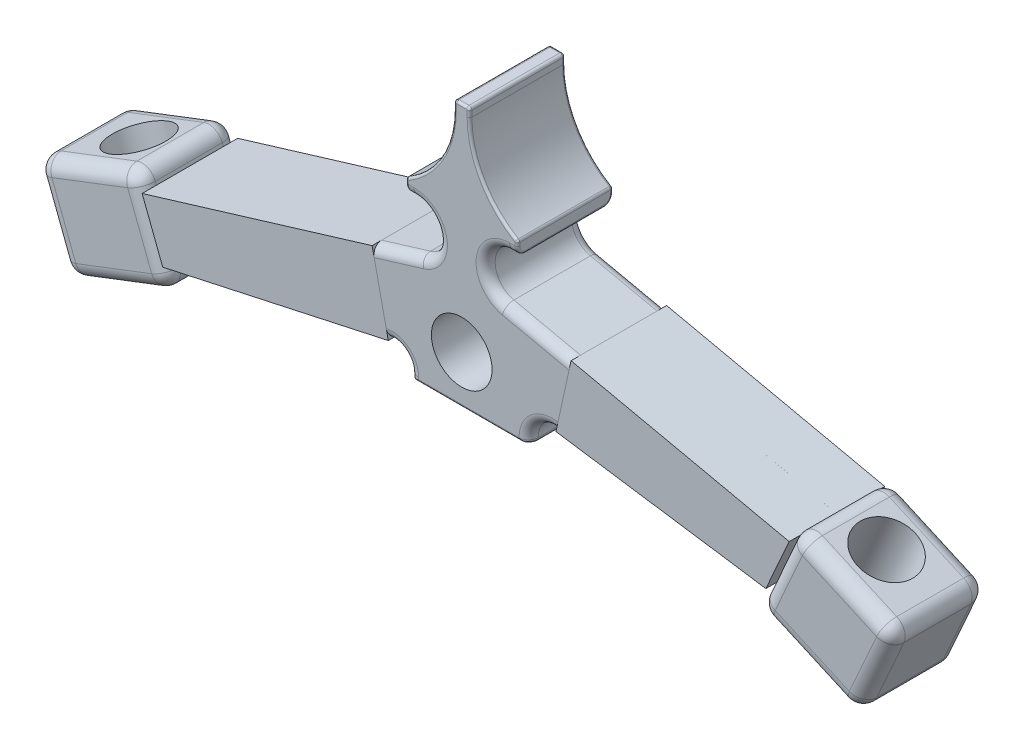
SolidWorks part; units mm, degrees
ref_plane "Спереди" through (0, 0, 0) normal (0, 0, 1) x (1, 0, 0)
ref_plane "Сверху" through (0, 0, 0) normal (0, 1, 0) x (1, 0, 0)
ref_plane "Справа" through (0, 0, 0) normal (1, 0, 0) x (0, 0, -1)
sketch "Эскиз1" plane through (0, 0, 0) normal (0, 0, 1) x (1, 0, 0)
  line L0 (0, 22.5) -> (0, -27.6904) construction
  line L1 (-5.38, -5) -> (6.88, -5)
  line L2 (7, -4.7455) -> (7, -4.88)
  line L3 (9.8652, -2.2723) -> (31.8283, -5.5155)
  line L4 (43.3051, 7.9688) -> (27.2773, -28.0304) construction
  line L5 (38.534, 4.6285) -> (24.6481, -26.5599) construction
  line L6 (31.8283, -5.5155) -> (34.2688, -0.0343)
  line L7 (34.2688, -0.0343) -> (4.4674, 6.4635)
  line L8 (9.8652, -2.2723) -> (11.4385, 4.9435) construction
  line L9 (-24.3174, 11.4061) -> (21.101, 11.4061) construction
  line L10 (2.5, 30.6701) -> (2.5, 16.1136) construction
  line L11 (-2.5, 30.6701) -> (-2.5, 16.1136) construction
  line L12 (-7.6835, -2.7953) -> (-31.292, -7.9428)
  line L13 (-39.703, 0.0166) -> (-27.7319, -31.1692) construction
  line L14 (-36.8657, 0.9965) -> (-28.1169, -21.7949) construction
  line L15 (-33.4422, -2.3413) -> (-31.292, -7.9428)
  line L16 (-33.4422, -2.3413) -> (-4.2738, 6.5139)
  line L17 (-5.5, -4.5539) -> (-5.5, -4.88)
  line L18 (-24.3174, 12.9061) -> (21.101, 12.9061) construction
  line L19 (-5.825, 12.7343) -> (-5.825, 11.7061)
  line L20 (-5.525, 11.4061) -> (-5, 11.4061)
  line L21 (5.825, 12.7343) -> (5.825, 11.7061)
  line L22 (5.525, 11.4061) -> (5, 11.4061)
  line L23 (-0.5141, 22.5) -> (0.5141, 22.5)
  line L24 (0.8141, 24.3476) -> (0.8141, 15.7225) construction
  line L25 (0.8141, 22.2) -> (0.8141, 21.5726)
  line L26 (-0.8141, 22.2) -> (-0.8141, 21.5726)
  line L27 (-42.4905, -14.5787) -> (-25.0412, -7.8805) construction
  line L28 (27.9625, -6.5003) -> (41.2129, -12.3997) construction
  line L29 (-7.6835, -2.7953) -> (0, -1.12) construction
  line L30 (-7.6835, -2.7953) -> (-9.3755, 4.9651) construction
  line L31 (10.6519, 1.3356) -> (33.0485, -2.7749) construction
  line L32 (-8.5295, 1.0849) -> (-32.3671, -5.142) construction
  circle A0 centre (0, 0) radius 3.175
  arc A1 (7, -4.7455) -> (9.8652, -2.2723) centre (9.5, -4.7455) cw
  arc A2 (5, 11.4061) -> (4.4674, 6.4635) centre (5, 8.9061) ccw
  arc A3 (-4.2738, 6.5139) -> (-5, 11.4061) centre (-5, 8.9061) ccw
  arc A4 (-7.6835, -2.7953) -> (-5.5, -4.5539) centre (-7.3, -4.5539) cw
  arc A5 (0.8141, 21.5726) -> (5.6791, 12.9918) centre (10.8141, 21.5726) ccw
  arc A6 (-0.8141, 21.5726) -> (-5.6791, 12.9918) centre (-10.8141, 21.5726) cw
  arc A7 (-0.5141, 22.5) -> (-0.8141, 22.2) centre (-0.5141, 22.2) ccw
  arc A8 (0.5141, 22.5) -> (0.8141, 22.2) centre (0.5141, 22.2) cw
  arc A9 (5.825, 11.7061) -> (5.525, 11.4061) centre (5.525, 11.7061) cw
  arc A10 (5.825, 12.7343) -> (5.6791, 12.9918) centre (5.525, 12.7343) ccw
  arc A11 (-5.825, 12.7343) -> (-5.6791, 12.9918) centre (-5.525, 12.7343) cw
  arc A12 (-5.525, 11.4061) -> (-5.825, 11.7061) centre (-5.525, 11.7061) cw
  arc A13 (7, -4.88) -> (6.88, -5) centre (6.88, -4.88) cw
  arc A14 (-5.38, -5) -> (-5.5, -4.88) centre (-5.38, -4.88) cw
  point P11 (7, -1.8492)
  point P38 (-5.5, -2.3192)
  point P56 (-0.8141, 22.5)
  point P59 (0.8141, 22.5)
  point P62 (5.825, 11.4061)
  point P65 (5.825, 12.9061)
  point P68 (-5.825, 12.9061)
  point P71 (-5.825, 11.4061)
  dimension "D1" = 6.35
  dimension "D7" = 2.5
  dimension "D14" = 5
  dimension "D24" = 1.8
  dimension "D27" = 20
  dimension "D28" = 0.3
  dimension "D29" = 0.12
  dimension "D2" = 5
  dimension "D3" = 7
  dimension "D4" = 8.4
  dimension "D5" = 4
  dimension "D6" = 24.8283
  dimension "D8" = 24
  dimension "D9" = 36.32
  dimension "D10" = 3
  dimension "D11" = 6
  dimension "D12" = 12.3
  dimension "D13" = 5
  dimension "D15" = 22.5
  dimension "D16" = 12.3
  dimension "D17" = 45
  dimension "D18" = 37.06
  dimension "D19" = 3
  dimension "D20" = 4
  dimension "D21" = 5.5
  dimension "D22" = 6
  dimension "D23" = 1.12
  dimension "D25" = 1.5
  dimension "D26" = 5.825
  dimension "D30" = 2.182
  dimension "D31" = 2.472
extrude "Бобышка-Вытянуть1" add sketch "Эскиз1" along normal blind 10
sketch "Эскиз2" plane through (1.5481, 7.1, 0) normal (0.213, 0.977, 0) x (0.977, -0.213, 0)
  line L0 (10.1228, 0) -> (10.1228, -10)
  line L1 (33.4894, -10) -> (2.988, -10) construction
  line L2 (33.4894, -10) -> (33.4894, 0)
ref_plane "Плоскость1" through (9.8905, -2.1565, 0) normal (-0.977, 0.213, 0) x (0, 0, 1)
sketch "Эскиз3" plane through (-2.1713, 7.1522, 0) normal (-0.2905, 0.9569, 0) x (0.9569, 0.2905, 0)
  line L0 (-7.5288, 0) -> (-7.5288, -10)
  line L1 (-2.1972, -10) -> (-32.6802, -10) construction
  line L2 (-32.6802, 0) -> (-32.6802, -10)
ref_plane "Плоскость2" through (-7.9166, -1.7261, 0) normal (-0.977, -0.213, 0) x (0, 0, 1)
split "Разделить1" trim tools "Плоскость1" bodies to split 101 resulting bodies 102 103
split "Разделить3" trim tools "Плоскость2" bodies to split 102 resulting bodies 105 106
fillet "Скругление4" radius 1 4 edges at (7.953, 5.7035, 10) (2.5144, 9.1739, 10) (5.2625, 11.4061, 10) (5.7371, 11.494, 10)
fillet "Скругление5" radius 1 4 edges at (7.953, 5.7035, 0) (2.5144, 9.1739, 0) (5.2625, 11.4061, 0) (5.7371, 11.494, 0)
fillet "Скругление6" radius 1 3 edges at (6.9649, -4.9649, 10) (7, -4.8127, 10) (7.8664, -2.853, 10)
fillet "Скругление7" radius 1 3 edges at (6.9649, -4.9649, 0) (7, -4.8127, 0) (7.8664, -2.853, 0)
fillet "Скругление8" radius 1 4 edges at (-5.7371, 11.494, 10) (-5.2625, 11.4061, 10) (-2.5271, 9.2732, 10) (-6.8246, 5.7395, 10)
fillet "Скругление9" radius 1 4 edges at (-5.7371, 11.494, 0) (-5.2625, 11.4061, 0) (-2.5271, 9.2732, 0) (-6.8246, 5.7395, 0)
fillet "Скругление10" radius 1 3 edges at (-6.1709, -3.1521, 0) (-5.5, -4.717, 0) (-5.4649, -4.9649, 0)
fillet "Скругление11" radius 1 3 edges at (-6.1709, -3.1521, 10) (-5.5, -4.717, 10) (-5.4649, -4.9649, 10)
fillet "Скругление12" radius 0.25 32 edges at (5.7201, 11.4782, 0.6272) (5.797, 11.5796, 9.563) (5.825, 12.028, 9.9258) (5.825, 12.5702, 10) (5.786, 12.8823, 10) (2.115, 16.6406, 10) (0.8141, 21.8863, 10) (0.7263, 22.4121, 10) (0, 22.5, 10) (-0.7263, 22.4121, 10) (-0.8141, 21.8863, 10) (-5.797, 11.5796, 0.437) (-5.7201, 11.4782, 9.3728) (-5.825, 12.028, 9.9258) (-5.825, 12.5702, 10) (-5.786, 12.8823, 10) (5.825, 12.028, 0.0742) (5.825, 12.5702, 0) (5.786, 12.8823, 0) (2.115, 16.6406, 0) (0.8141, 21.8863, 0) (0.7263, 22.4121, 0) (0, 22.5, 0) (-0.7263, 22.4121, 0) (-0.8141, 21.8863, 0) (-5.825, 12.028, 0.0742) (-5.825, 12.5702, 0) (-5.786, 12.8823, 0) (0.75, -5, 0) (0.75, -5, 10) (-2.115, 16.6406, 10) (-2.115, 16.6406, 0)
sketch "Эскиз5" plane through (9.8905, -2.1565, 0) normal (-0.977, 0.213, 0) x (0, 0, 1)
  line L0 (0, 3.575) -> (10, 3.575) construction
  line L1 (5, 7.2668) -> (5, -0.1185) construction
  line L4 (1, -0.1185) -> (9, -0.1185)
  line L5 (0, 6.2668) -> (0, 0.8831)
  line L6 (9, 7.2668) -> (1, 7.2668)
  line L7 (10, 0.8831) -> (10, 6.2668)
  line L8 (1, -0.1185) -> (9, -0.1185)
  line L9 (0, 6.2668) -> (0, 0.8831)
  line L10 (9, 7.2668) -> (1, 7.2668)
  line L11 (10, 0.8831) -> (10, 6.2668)
  arc A2 (1, 7.2668) -> (0, 6.2668) centre (1, 6.2668) ccw
  arc A3 (10, 6.2668) -> (9, 7.2668) centre (9, 6.2668) ccw
  arc A4 (1, 7.2668) -> (0, 6.2668) centre (1, 6.2668) ccw
  arc A5 (10, 6.2668) -> (9, 7.2668) centre (9, 6.2668) ccw
  spline S2 degree 3 poles (1584.789, -2543.7862) (77.5069, 101.1342) (-6.0552, 6.5345) (0.3851, 0.0826) (0.496, 0.0081) (10.0275, -3.9515) (71.4137, 138.3627) (-2692.7779, 1311.8392) knots -16.714616 -16.714616 -16.714616 -16.714616 0.5 0.5 0.75 0.75 20.180106 20.180106 20.180106 20.180106 only from (0, 0.8831) to (1, -0.1185)
  spline S3 degree 3 poles (2541.7302, 1603.6618) (-91.1985, 76.9419) (3.3746, -6.178) (9.7997, 0.2679) (9.8739, 0.3789) (13.85, 9.9977) (-130.5199, 71.5734) (-1292.6871, -2697.1856) knots -16.683546 -16.683546 -16.683546 -16.683546 0.5 0.5 0.75 0.75 20.342713 20.342713 20.342713 20.342713 only from (9, -0.1185) to (10, 0.8831)
  spline S4 degree 3 poles (0, 0.8831) (0, 0.6188) (0.1085, 0.3596) (0.3851, 0.0826) (0.496, 0.0081) (0.7382, -0.0925) (0.8678, -0.1185) (1, -0.1185) knots 0 0 0 0 0.5 0.5 0.75 0.75 1 1 1 1
  spline S5 degree 3 poles (9, -0.1185) (9.2643, -0.1185) (9.5233, -0.0094) (9.7997, 0.2679) (9.8739, 0.3789) (9.974, 0.6213) (10, 0.751) (10, 0.8831) knots 0 0 0 0 0.5 0.5 0.75 0.75 1 1 1 1
  point P14 (5, 3.575)
  dimension "D1" = 0
ref_plane "Плоскость3" through (28.6122, -12.739, 0) normal (0.9135, -0.4067, 0) x (0, 0, -1)
sketch "Эскиз4" plane through (28.6122, -12.739, 0) normal (0.9135, -0.4067, 0) x (0, 0, -1)
  circle A0 centre (-5, 10.9071) radius 3
  dimension "D1" = 6
  dimension "D2" = 5
loft "По сечениям1" add profiles "Эскиз5", "Эскиз4"
sketch "Эскиз6" plane through (-7.9166, -1.7261, 0) normal (-0.977, -0.213, 0) x (0, 0, 1)
  line L0 (0, 2.877) -> (10, 2.8754) construction
  line L1 (5, 6.8484) -> (5, -1.0943) construction
  line L4 (1, -1.0943) -> (9, -1.0943)
  line L5 (10, -0.0943) -> (10, 5.8452)
  line L6 (9, 6.8484) -> (1, 6.8484)
  line L7 (0, 5.8452) -> (0, -0.0943)
  line L8 (1, -1.0943) -> (9, -1.0943)
  line L9 (10, -0.0943) -> (10, 5.8452)
  line L10 (9, 6.8484) -> (1, 6.8484)
  line L11 (0, 5.8452) -> (0, -0.0943)
  arc A2 (9, -1.0943) -> (10, -0.0943) centre (9, -0.0943) ccw
  arc A3 (0, -0.0943) -> (1, -1.0943) centre (1, -0.0943) ccw
  arc A4 (9, -1.0943) -> (10, -0.0943) centre (9, -0.0943) ccw
  arc A5 (0, -0.0943) -> (1, -1.0943) centre (1, -0.0943) ccw
  ellipse E2 centre (9, 5.8452) end of major axis (9, 6.8484) minor radius 1 (10, 5.8452) -> (9, 6.8484) ccw
  ellipse E3 centre (1, 5.8452) end of major axis (1, 6.8484) minor radius 1 (1, 6.8484) -> (0, 5.8452) ccw
  ellipse E4 centre (9, 5.8452) end of major axis (9, 6.8484) minor radius 1 (10, 5.8452) -> (9, 6.8484) ccw
  ellipse E5 centre (1, 5.8452) end of major axis (1, 6.8484) minor radius 1 (1, 6.8484) -> (0, 5.8452) ccw
  point P9 (5, 2.8762)
  dimension "D1" = 0
ref_plane "Плоскость4" through (-29.9306, -11.4893, 0) normal (0.9336, 0.3584, 0) x (0, 0, -1)
sketch "Эскиз7" plane through (-29.9306, -11.4893, 0) normal (0.9336, 0.3584, 0) x (0, 0, -1)
  circle A0 centre (-5, 6.7988) radius 3
  dimension "D1" = 6
  dimension "D2" = 5
loft "По сечениям2" add profiles "Эскиз6", "Эскиз7"
sketch "Эскиз8" plane through (28.6122, -12.739, 0) normal (0.9135, -0.4067, 0) x (0, 0, -1)
  line L0 (-5, 10.9071) -> (0, 10.9071) construction
  line L1 (-10, 15.4351) -> (0, 15.4351)
  line L2 (-10, 15.4351) -> (-10, 5.4351)
  line L3 (-10, 5.4351) -> (0, 5.4351)
  line L4 (0, 15.4351) -> (0, 5.4351)
  line L5 (-5, 10.9071) -> (-10, 10.9071) construction
  dimension "D1" = 10
extrude "Бобышка-Вытянуть2" add sketch "Эскиз8" along normal blind 11.5
sketch "Эскиз9" plane through (6.278, 14.1006, 0) normal (0.4067, 0.9135, 0) x (0.9135, -0.4067, 0)
  line L0 (42.82, 0) -> (31.32, 0) construction
  line L1 (31.32, 0) -> (31.32, -10) construction
  circle A0 centre (36.32, -5) radius 3
  dimension "D1" = 6
  dimension "D2" = 5
  dimension "D3" = 5
extrude "Вырез-Вытянуть1" cut sketch "Эскиз9" against normal blind 11.5
sketch "Эскиз10" plane through (-29.9306, -11.4893, 0) normal (0.9336, 0.3584, 0) x (0, 0, -1)
  line L1 (0, 11.6168) -> (-10, 11.6168)
  line L2 (0, 11.6168) -> (0, 1.6168)
  line L3 (0, 1.6168) -> (-10, 1.6168)
  line L4 (-10, 11.6168) -> (-10, 1.6168)
  dimension "D1" = 10
  dimension "D2" = 10
extrude "Бобышка-Вытянуть3" add sketch "Эскиз10" against normal blind 11.5
sketch "Эскиз11" plane through (-4.1631, 10.8453, 0) normal (-0.3584, 0.9336, 0) x (0.9336, 0.3584, 0)
  line L0 (-32.06, 0) -> (-32.06, -10) construction
  line L1 (-44.8929, 0) -> (-26.2021, 0) construction
  circle A0 centre (-37.06, -5) radius 3
  dimension "D1" = 6
  dimension "D2" = 5
  dimension "D3" = 5
extrude "Вырез-Вытянуть2" cut sketch "Эскиз11" against normal blind 11.5
fillet "Скругление13" radius 1.5 24 edges at (41.3287, -12.4513, 5) (36.0758, -10.1125, 10) (30.8229, -7.7738, 5) (36.0758, -10.1125, 0) (32.8566, -3.2061, 0) (43.3623, -7.8836, 0) (43.3623, -7.8836, 10) (32.8566, -3.2061, 10) (34.8903, 1.3616, 5) (40.1431, -0.9771, 0) (45.396, -3.3158, 5) (40.1431, -0.9771, 10) (-35.8781, -12.0404, 0) (-30.51, -9.9798, 5) (-35.8781, -12.0404, 10) (-41.2462, -14.1011, 5) (-39.4618, -2.7046, 0) (-34.0937, -0.644, 5) (-39.4618, -2.7046, 10) (-44.8299, -4.7653, 5) (-43.038, -9.4332, 0) (-32.3019, -5.3119, 0) (-32.3019, -5.3119, 10) (-43.038, -9.4332, 10)
